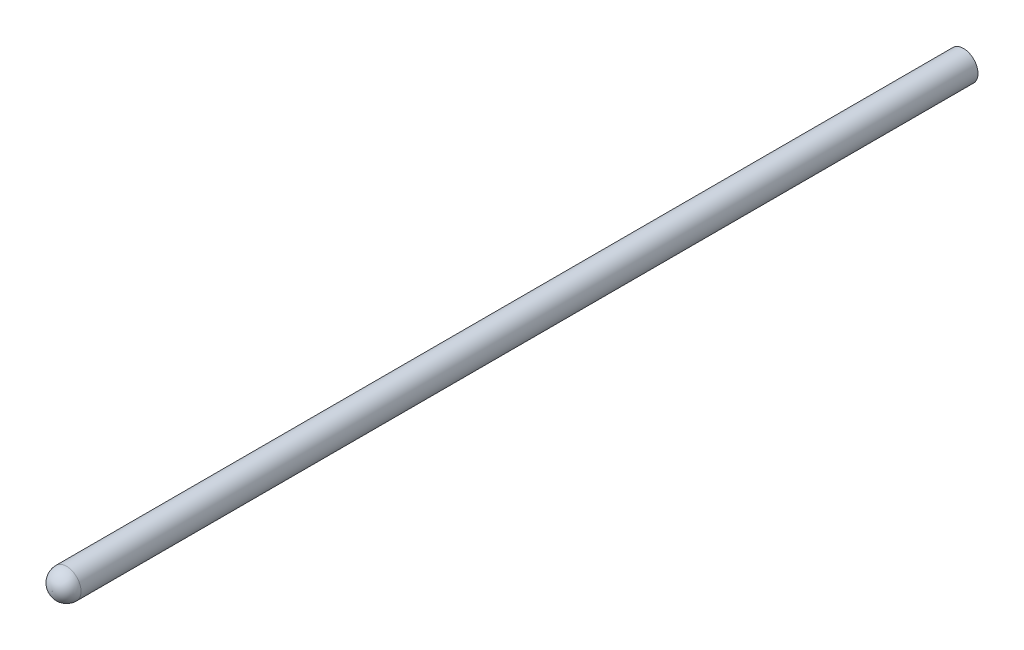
SolidWorks part; units mm, degrees
ref_plane "Front Plane" through (0, 0, 0) normal (0, 0, 1) x (1, 0, 0)
ref_plane "Top Plane" through (0, 0, 0) normal (0, 1, 0) x (1, 0, 0)
ref_plane "Right Plane" through (0, 0, 0) normal (1, 0, 0) x (0, 0, -1)
sketch "Sketch2" plane through (0, 0, 0) normal (0, 0, 1) x (1, 0, 0)
  circle A0 centre (0, 0) radius 3.25
  dimension "D1" = 6.5
extrude "Boss-Extrude1" add sketch "Sketch2" along normal blind 203.2
fillet "Fillet1" radius 3.175 1 edges at (3.25, 0, 203.2)
